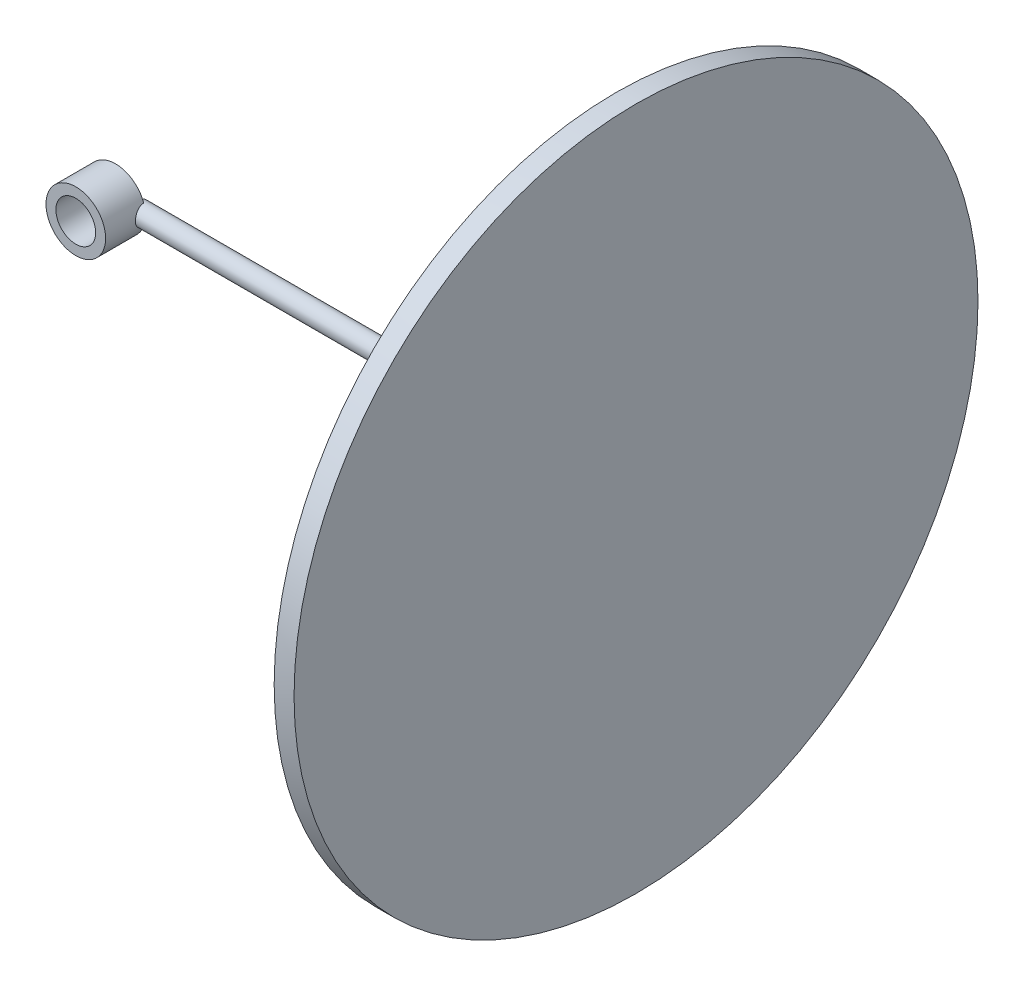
SolidWorks part; units mm, degrees
ref_plane "Face" through (0, 0, 0) normal (0, 0, 1) x (1, 0, 0)
ref_plane "Dessus" through (0, 0, 0) normal (0, 1, 0) x (1, 0, 0)
ref_plane "Droite" through (0, 0, 0) normal (1, 0, 0) x (0, 0, -1)
sketch "Esquisse1" plane through (0, 0, 0) normal (0, 0, 1) x (1, 0, 0)
  line L0 (-73.8428, 4.7044) -> (-257.8051, 4.7044) construction
  line L2 (-88.2759, 90.7044) -> (-88.2759, 7.2044)
  line L3 (-83.2759, 90.7044) -> (-83.2759, 4.7044)
  line L4 (-83.2759, 4.7044) -> (-208.2759, 4.7044)
  line L5 (-85.7759, 90.7044) -> (-85.7759, 85.554) construction
  line L6 (-208.2759, 7.2044) -> (-88.2759, 7.2044)
  line L7 (-208.2759, 7.2044) -> (-208.2759, 4.7044)
  arc A0 (-83.2759, 90.7044) -> (-88.2759, 90.7044) centre (-85.7759, 4.7044) ccw
  dimension "D1" = 5
  dimension "D2" = 5
  dimension "D3" = 172
  dimension "D4" = 120
revolve "Révolution1" add sketch "Esquisse1" angle 360 about L0
sketch "Esquisse2" plane through (0, 0, 0) normal (0, 0, 1) x (1, 0, 0)
  line L0 (-73.8428, 4.7044) -> (-257.8051, 4.7044) construction
  circle A0 centre (-214.1601, 4.7044) radius 7.5
  circle A1 centre (-214.1601, 4.7044) radius 5
  dimension "D1" = 15
  dimension "D2" = 10
extrude "Extrusion1" add sketch "Esquisse2" along normal blind 10
ref_plane "Plan1" through (0, 4.7044, 0) normal (0, -1, 0) x (1, 0, 0)
ref_point "Point1"
